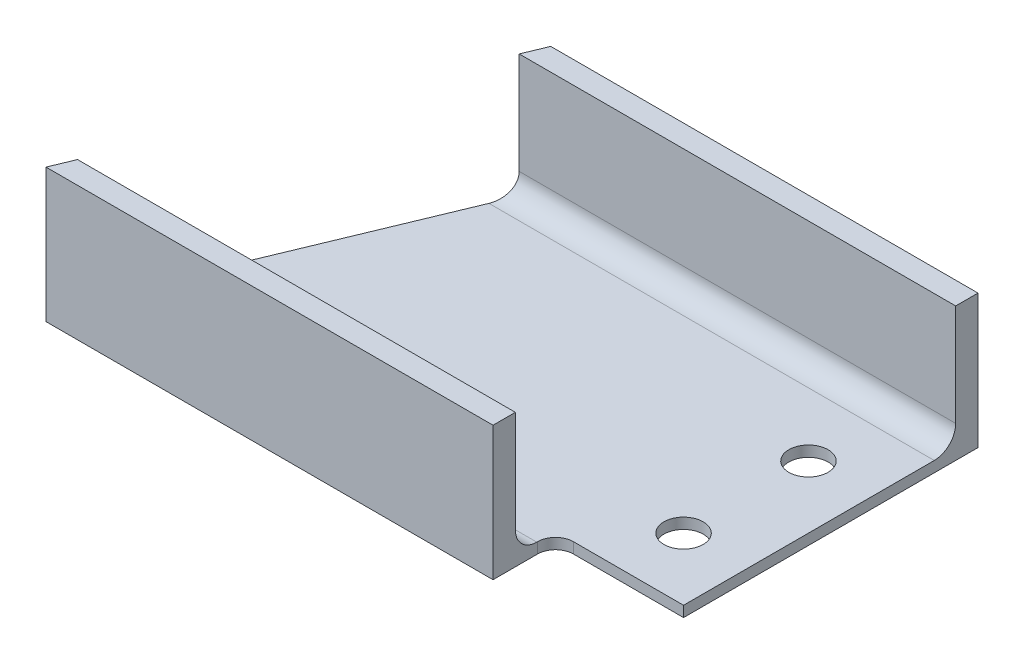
SolidWorks part; units mm, degrees
ref_plane "Front Plane" through (0, 0, 0) normal (0, 0, 1) x (1, 0, 0)
ref_plane "Top Plane" through (0, 0, 0) normal (0, 1, 0) x (1, 0, 0)
ref_plane "Right Plane" through (0, 0, 0) normal (1, 0, 0) x (0, 0, -1)
ref_plane "Member Plane" through (0, 0, 0) normal (0, 1, 0) x (-1, 0, 0)
sketch "Member Sketch" plane through (0, 0, 0) normal (0, 1, 0) x (1, 0, 0)
  line L0 (0, 0) -> (345, 0)
  line L2 (0, 0) -> (345, 0) construction
other "Structural Member1"
ref_plane "Plane1" through (0, 0, -100) normal (1, 0, 0) x (0, 1, 0)
sketch "Sketch1" plane through (0, 0, -100) normal (1, 0, 0) x (0, 1, 0)
  line L0 (0, 100) -> (0, -100)
  line L2 (0, 100) -> (75, 100)
  line L3 (75, 87.5) -> (18, 87.5)
  line L4 (6, 75.5) -> (6, -75.5)
  line L5 (75, 100) -> (75, 87.5)
  line L6 (75, -100) -> (75, -87.5)
  line L7 (75, -87.5) -> (18, -87.5)
  line L8 (0, -100) -> (75, -100)
  line L9 (37.5, 100) -> (37.5, -100) construction
  line L10 (0, 0) -> (75, 0) construction
  line L11 (75, 87.5) -> (75, -87.5) construction
  line L13 (36, 100) -> (36, -100) construction
  arc A0 (6, -75.5) -> (18, -87.5) centre (18, -75.5) ccw
  arc A1 (6, 75.5) -> (18, 87.5) centre (18, 75.5) cw
  circle A2 centre (36, 100) radius 1.5 construction
  circle A3 centre (36, -100) radius 1.5 construction
  circle A4 centre (36, 0) radius 1.5 construction
  point P0 (0, 0)
  point P10 (6, 0)
  point P19 (6, -100)
  point P20 (0, -87.5)
  point P21 (0, 87.5)
  point P22 (6, 100)
  point P31 (37.5, 0)
  dimension "D1" = 3
  dimension "Root Radius(r1)" = 12
  dimension "Flange Thickness(T)" = 12.5
  dimension "Section Depth(D)" = 200
  dimension "Flange Width(B)" = 75
  dimension "Web Thickness(t)" = 6
  dimension "BackGuage" = 36
ref_plane "Plane2" through (0, 0, 0) normal (-0.9239, 0, -0.3827) x (-0.3827, 0, 0.9239)
other "Trim/Extend1"
other "0008-AABE002-CN02-FP03D02-1 - MEMBER2 CAVITY"
other "0008-AABE002<1>@0008-AA/0008-AABE002-CN02-FP03<1>@0008-AABE002/0008-AABE002-CN02-FP03D02<1>@0008-AABE002-CN02-FP031"
other "0008-AABE002-CN02-FP03D01-1 - MEMBER2 CAVITY"
other "0008-AABE002<1>@0008-AA/0008-AABE002-CN02-FP03<1>@0008-AABE002/0008-AABE002-CN02-FP03D01<1>@0008-AABE002-CN02-FP031"
